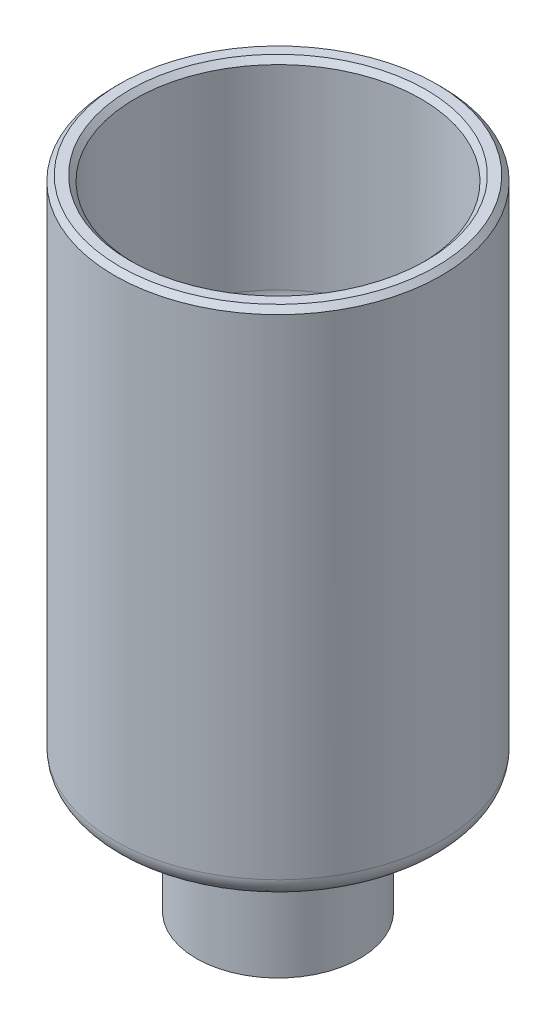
SolidWorks part; units mm, degrees
ref_plane "Front Plane" through (0, 0, 0) normal (0, 0, 1) x (1, 0, 0)
ref_plane "Top Plane" through (0, 0, 0) normal (0, 1, 0) x (1, 0, 0)
ref_plane "Right Plane" through (0, 0, 0) normal (1, 0, 0) x (0, 0, -1)
sketch "Sketch1" plane through (0, 0, 0) normal (0, 0, 1) x (1, 0, 0)
  line L0 (1.7907, 0) -> (1.7907, 8.2587)
  line L1 (0, 0) -> (0, -41.7879) construction
  line L2 (1.7907, 0) -> (3.175, 0)
  line L3 (3.175, 0) -> (3.175, 3.4925)
  line L4 (1.7907, 8.2587) -> (2.7051, 9.8425)
  line L5 (2.7051, 9.8425) -> (2.7051, 16.1925)
  line L6 (2.7051, 16.1925) -> (4.7625, 16.1925)
  line L7 (6.35, 24.765) -> (6.35, 5.5499)
  line L9 (5.5499, 16.9799) -> (5.5499, 24.765)
  line L10 (5.5499, 24.765) -> (6.35, 24.765)
  line L11 (3.8227, 4.7625) -> (2.6162, 4.7625)
  line L12 (3.175, 3.4925) -> (2.6162, 3.4925)
  line L13 (3.8227, 4.7625) -> (3.8227, 6.0325)
  line L14 (3.8227, 6.0325) -> (5.9563, 6.0325)
  line L15 (5.9563, 4.868) -> (5.9563, 6.0325)
  line L16 (2.6162, 3.4925) -> (2.6162, 4.7625)
  arc A0 (5.5499, 16.9799) -> (4.7625, 16.1925) centre (4.7625, 16.9799) cw
  arc A1 (6.35, 5.5499) -> (5.9563, 4.868) centre (5.5626, 5.5499) cw
  point P21 (5.5499, 16.1925)
  dimension "D16" = 0.7874
  dimension "D18" = 0.7874
  dimension "D1" = 3.5814
  dimension "D2" = 5.4102
  dimension "D3" = 11.0998
  dimension "D4" = 6.35
  dimension "D5" = 12.7
  dimension "D6" = 11.43
  dimension "D7" = 6.35
  dimension "D8" = 1.27
  dimension "D9" = 24.765
  dimension "D10" = 7.6454
  dimension "D11" = 2.1336
  dimension "D12" = 4.7625
  dimension "D13" = 1.27
  dimension "D14" = 5.2324
  dimension "D15" = 30
  dimension "D17" = 8.5725
revolve "Revolve1" add sketch "Sketch1" angle 360 about L1
sketch "Sketch2" plane through (0, 0, 0) normal (0, -1, 0) x (1, 0, 0)
  circle A0 centre (2.286, 0) radius 0.3175
  circle A1 centre (0, 0) radius 1.7907 construction
  dimension "D1" = 0.635
  dimension "D2" = 0.1778
extrude "Cut-Extrude2" cut sketch "Sketch2" against normal blind 3.175
sketch "Sketch3" plane through (0, 3.175, 0) normal (0, -1, 0) x (1, 0, 0)
  circle A0 centre (2.286, 0) radius 0.254
  dimension "D1" = 0.508
extrude "Boss-Extrude2" [suppressed] add sketch "Sketch3" along normal blind 19.05
chamfer "Chamfer1" distance 0.2032 angle 45 2 edges at (0, 24.765, 6.35) (0, 24.765, 5.5499)
